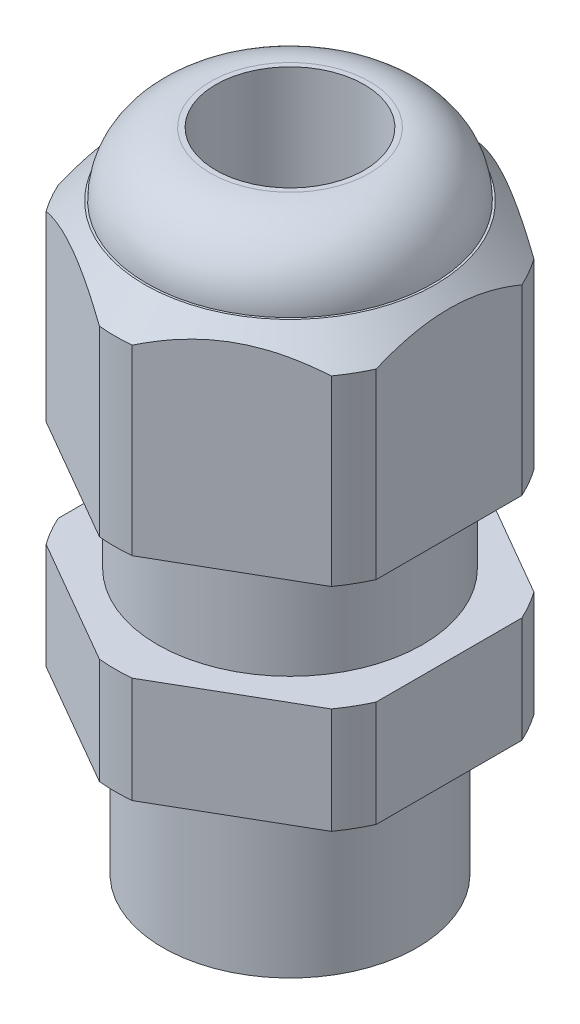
SolidWorks part; units mm, degrees
ref_plane "Face" through (0, 0, 0) normal (0, 0, 1) x (1, 0, 0)
ref_plane "Dessus" through (0, 0, 0) normal (0, 1, 0) x (1, 0, 0)
ref_plane "Droite" through (0, 0, 0) normal (1, 0, 0) x (0, 0, -1)
sketch "Esquisse1" plane through (0, 0, 0) normal (0, 0, 1) x (1, 0, 0)
  line L0 (0, 0) -> (0, 72.5436) construction
  line L1 (4.5, 0) -> (6, 0)
  line L2 (6, 0) -> (6, 7.5)
  line L3 (6, 7.5) -> (8.25, 7.5)
  line L4 (8.25, 7.5) -> (8.25, 12.5)
  line L5 (8.25, 12.5) -> (6.25, 12.5)
  line L6 (6.25, 12.5) -> (6.25, 17.5)
  line L7 (6.25, 17.5) -> (8.25, 17.5)
  line L8 (8.25, 17.5) -> (8.25, 27.5)
  line L9 (8.25, 27.5) -> (6.75, 27.5)
  line L10 (6.75, 27.5) -> (6.75, 30.5)
  line L11 (6.75, 30.5) -> (3.5, 30.5)
  line L12 (4.5, 0) -> (4.5, 24.0548)
  line L13 (4.5, 24.0548) -> (3.5, 24.0548)
  line L14 (3.5, 24.0548) -> (3.5, 30.5)
  dimension "D1" = 7.5
  dimension "D2" = 12
  dimension "D3" = 16.5
  dimension "D4" = 5
  dimension "D5" = 5
  dimension "D6" = 12.5
  dimension "D7" = 16.5
  dimension "D8" = 13.5
  dimension "D9" = 10
  dimension "D10" = 30.5
  dimension "D11" = 7
  dimension "D12" = 9
revolve "Révolution1" add sketch "Esquisse1" angle 360 about L0
fillet "Congé1" radius 3 1 edges at (0, 30.5, -6.75)
chamfer "Chanfrein2" distance 1.4 angle 45 1 edges at (0, 27.5, -8.25)
sketch "Esquisse2" plane through (0, 27.5, 0) normal (0, 1, 0) x (-1, 0, 0)
  line L1 (-7.5, 4.3301) -> (-7.5, -4.3301)
  line L2 (-7.5, -4.3301) -> (0, -8.6603)
  line L3 (0, -8.6603) -> (7.5, -4.3301)
  line L4 (7.5, -4.3301) -> (7.5, 4.3301)
  line L5 (7.5, 4.3301) -> (0, 8.6603)
  line L6 (0, 8.6603) -> (-7.5, 4.3301)
  circle A0 centre (0, 0) radius 7.5 construction
  dimension "D1" = 15
extrude "Enlèv. mat.-Extru.1" cut sketch "Esquisse2" against normal through all flip side to cut
